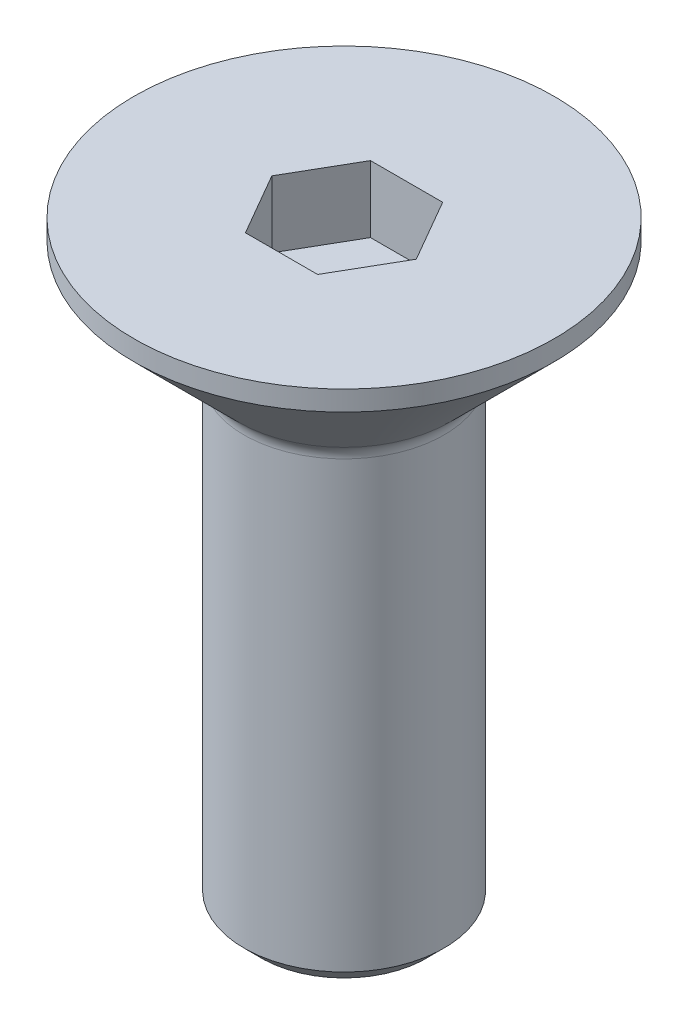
SolidWorks part; units mm, degrees
ref_plane "Plan1" through (0, 0, 0) normal (0, 0, 1) x (1, 0, 0)
ref_plane "Plan2" through (0, 0, 0) normal (0, 1, 0) x (1, 0, 0)
ref_plane "Plan3" through (0, 0, 0) normal (1, 0, 0) x (0, 0, -1)
sketch "Esquisse1" plane through (0, 0, 0) normal (0, 0, 1) x (1, 0, 0)
  line L0 (0, 0) -> (0, -12) construction
  line L1 (4.2, -0.4) -> (2.1172, -2.4828)
  line L2 (4.2, -0.4) -> (4.2, 0)
  line L3 (4.2, 0) -> (0, 0)
  line L4 (2, -2.7657) -> (2, -11.65)
  line L5 (1.65, -12) -> (0, -12)
  line L6 (2, -11.65) -> (1.65, -12)
  line L7 (0, 0) -> (0, -12)
  line L8 (2.1172, -2.4828) -> (2, -2.6) construction
  line L9 (2, -2.7657) -> (2, -2.6) construction
  arc A0 (2.1172, -2.4828) -> (2, -2.7657) centre (2.4, -2.7657) ccw
  point P12 (2, -12)
  dimension "C" = 0.4
  dimension "D1" = 8.4
  dimension "R" = 0.35
  dimension "D2" = 45
  dimension "D4" = 45
  dimension "L1" = 12
  dimension "H" = 2.6
  dimension "D" = 4
  dimension "H1" = 0.4
revolve "Révolution1" add sketch "Esquisse1" angle 360 about L0
sketch "Esquisse2" plane through (0, 0, 0) normal (0, 1, 0) x (1, 0, 0)
  line L1 (1.4434, 0) -> (0.7217, 1.25)
  line L2 (0.7217, 1.25) -> (-0.7217, 1.25)
  line L3 (-0.7217, 1.25) -> (-1.4434, 0)
  line L4 (-1.4434, 0) -> (-0.7217, -1.25)
  line L5 (-0.7217, -1.25) -> (0.7217, -1.25)
  line L6 (0.7217, -1.25) -> (1.4434, 0)
  circle A0 centre (0, 0) radius 1.25 construction
  dimension "S" = 2.5
extrude "Enlèv. mat.-Extru.1" cut sketch "Esquisse2" against normal blind 1.3333
equation "\"R@Esquisse1\"=(\"D@Esquisse1\"-\"D2@Représentation de filetage1\")/2"
equation "\"C@Esquisse1\"=\"D@Esquisse1\"/10"
equation "\"Prof@Enlèv. mat.-Extru.1\"=\"D@Esquisse1\"/3"
